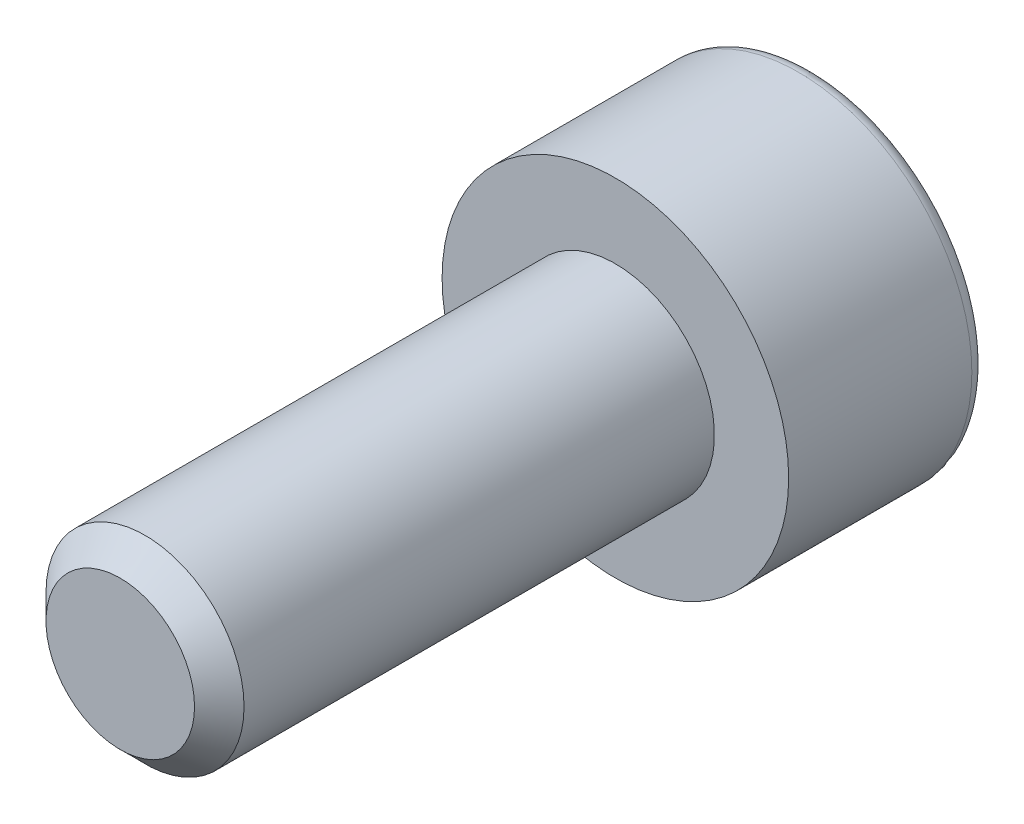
SolidWorks part; units mm, degrees
ref_plane "Face" through (0, 0, 0) normal (0, 0, 1) x (1, 0, 0)
ref_plane "Dessus" through (0, 0, 0) normal (0, 1, 0) x (1, 0, 0)
ref_plane "Droite" through (0, 0, 0) normal (1, 0, 0) x (0, 0, -1)
sketch "Esquisse1" plane through (0, 0, 0) normal (0, 0, 1) x (1, 0, 0)
  circle A0 centre (0, 0) radius 2
  dimension "D1" = 4
extrude "Base-Extrusion" add sketch "Esquisse1" along normal blind 10
chamfer "Chanfrein1" distance 0.5 angle 45 1 edges at (2, 0, 10)
sketch "Esquisse2" plane through (0, 0, 0) normal (0, 0, -1) x (-1, 0, 0)
  circle A0 centre (0, 0) radius 3.5
  dimension "D1" = 7
extrude "Boss.-Extru.1" add sketch "Esquisse2" along normal blind 4
fillet "Congé1" radius 0.3 1 edges at (-3.5, 0, -4)
sketch "Esquisse3" plane through (0, 0, -4) normal (0, 0, -1) x (-1, 0, 0)
  line L1 (0, 1.7321) -> (-1.5, 0.866)
  line L2 (-1.5, 0.866) -> (-1.5, -0.866)
  line L3 (-1.5, -0.866) -> (0, -1.7321)
  line L4 (0, -1.7321) -> (1.5, -0.866)
  line L5 (1.5, -0.866) -> (1.5, 0.866)
  line L6 (1.5, 0.866) -> (0, 1.7321)
  circle A0 centre (0, 0) radius 1.5 construction
  dimension "D1" = 3
extrude "Enlèv. mat.-Extru.1" cut sketch "Esquisse3" against normal blind 4
